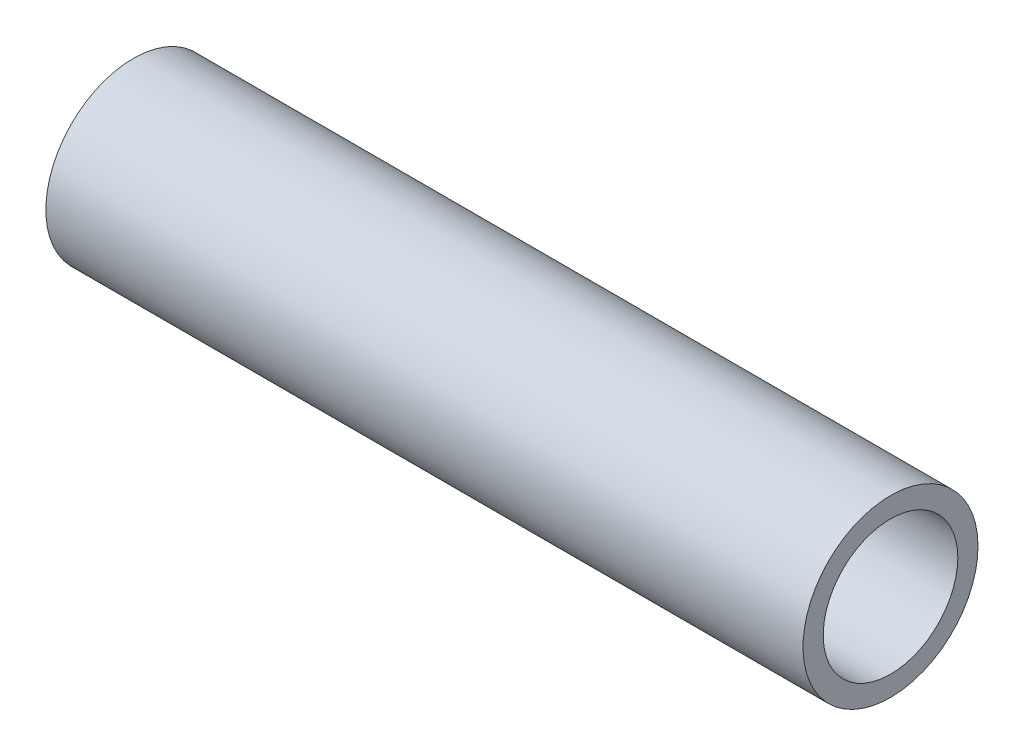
SolidWorks part; units mm, degrees
ref_plane "Front" through (0, 0, 0) normal (0, 0, 1) x (1, 0, 0)
ref_plane "Top" through (0, 0, 0) normal (0, 1, 0) x (1, 0, 0)
ref_plane "Right" through (0, 0, 0) normal (1, 0, 0) x (0, 0, -1)
sketch "Sketch1" plane through (0, 0, 0) normal (0, 0, 1) x (1, 0, 0)
  line L0 (0, 0) -> (142.875, 0)
  line L1 (9.9848, 0) -> (-9.9848, 0) construction
  dimension "D1" = 142.875
other "Structural Member1"
ref_plane "Plane1" through (0, 0, 0) normal (1, 0, 0) x (0, 0, -1)
sketch "Sketch11" plane through (0, 0, 0) normal (1, 0, 0) x (0, 0, -1)
  circle A0 centre (0, 0) radius 12.7
  circle A1 centre (0, 0) radius 16.51
  point P3 (0, 0)
  dimension "D1" = 33.02
  dimension "D2" = 25.4
